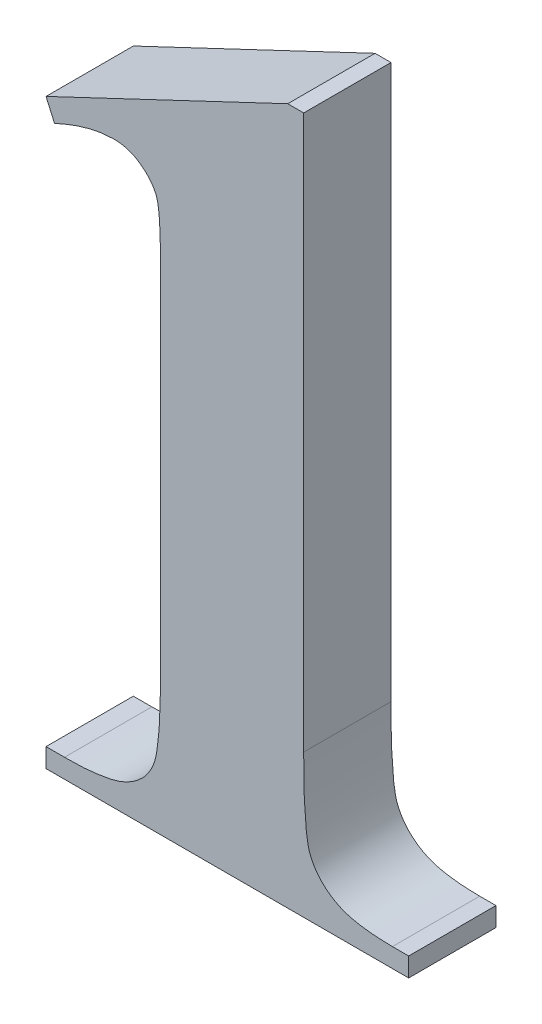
SolidWorks part; units mm, degrees
ref_plane "Front" through (0, 0, 0) normal (0, 0, 1) x (1, 0, 0)
ref_plane "Top" through (0, 0, 0) normal (0, 1, 0) x (1, 0, 0)
ref_plane "Right" through (0, 0, 0) normal (1, 0, 0) x (0, 0, -1)
sketch "Sketch2" plane through (0, 0, 0) normal (0, 0, 1) x (1, 0, 0)
  line L1 (-28.575, 57.15) -> (28.575, 57.15)
  line L2 (-28.575, 57.15) -> (-28.575, 0)
  line L3 (-28.575, 0) -> (28.575, 0)
  line L4 (28.575, 57.15) -> (28.575, 0)
  dimension "D1" = 57.15
  dimension "D2" = 57.15
extrude "Base-Extrude" add sketch "Sketch2" against normal blind 6.35
sketch "Sketch4" plane through (0, 0, 0) normal (0, 0, 1) x (1, 0, 0)
  text T0 "1" font "Times New Roman" height 50.8
extrude "Cut-Extrude1" cut sketch "Sketch4" against normal through all flip side to cut
